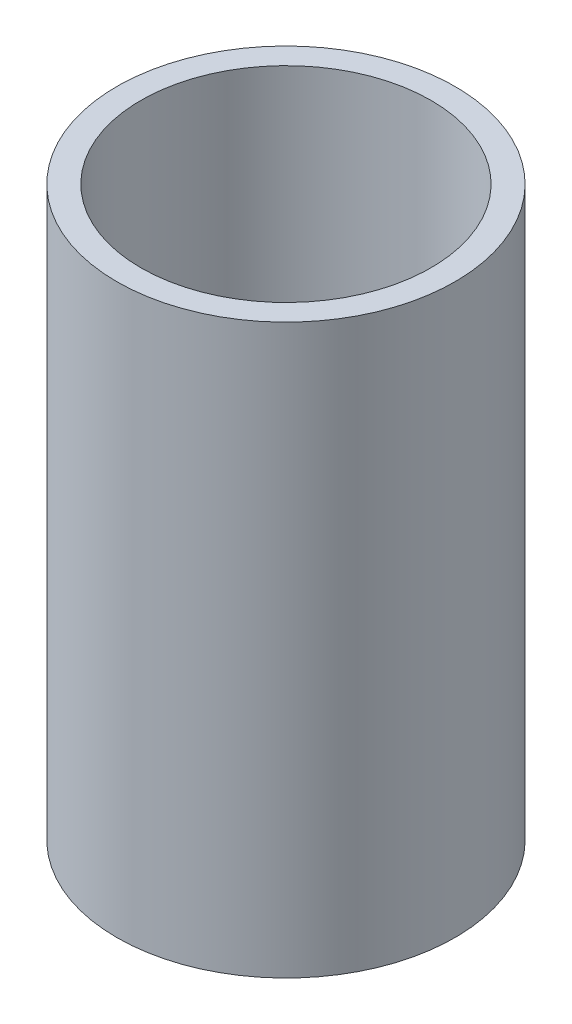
SolidWorks part; units mm, degrees
ref_plane "Front Plane" through (0, 0, 0) normal (0, 0, 1) x (1, 0, 0)
ref_plane "Top Plane" through (0, 0, 0) normal (0, 1, 0) x (1, 0, 0)
ref_plane "Right Plane" through (0, 0, 0) normal (1, 0, 0) x (0, 0, -1)
sketch "Sketch1" plane through (0, 0, 0) normal (0, 1, 0) x (1, 0, 0)
  circle A0 centre (0, 0) radius 83.185
  circle A1 centre (0, 0) radius 71.3525
  dimension "D1" = 166.37
  dimension "D2" = 142.705
extrude "Boss-Extrude1" add sketch "Sketch1" along normal blind 279.4
sketch "Sketch2" plane through (0, 0, 0) normal (0, -1, 0) x (1, 0, 0)
  line L0 (0, 0) -> (0, 83.185)
  circle A0 centre (0, 0) radius 83.185 construction
ref_plane "Plane1" through (0, 0, 0) normal (1, 0, 0) x (0, 0, 1)
sketch "Sketch4" plane through (0, 0, 0) normal (1, 0, 0) x (0, 0, 1)
  line L0 (83.185, 0) -> (83.185, -279.4)
  line L1 (83.185, -279.4) -> (71.3525, -279.4)
  line L2 (71.3525, -279.4) -> (71.3525, 0)
  line L3 (71.3525, 0) -> (83.185, 0)
  line L4 (70.4889, -279.4) -> (71.3525, -278.5364)
  line L5 (0, 0) -> (0, -358.7098)
  line L6 (70.4889, -279.4) -> (71.3525, -279.4)
  dimension "D1" = 135
  dimension "D2" = 0.8636
sketch "Sketch5" plane through (0, 279.4, 0) normal (0, 1, 0) x (1, 0, 0)
  circle A0 centre (0, 0) radius 83.185
  circle A1 centre (0, 0) radius 71.3525
  circle A2 centre (0, 0) radius 71.3525 construction
  dimension "D2" = 166.37
extrude "Boss-Extrude2" add sketch "Sketch5" against normal blind 12.7
sketch "Sketch6" plane through (0, 28.1168, 0) normal (0.5394, 0, -0.8421) x (-0.8421, 0, -0.5394)
  line L0 (71.3525, -24.9418) -> (68.1775, -28.1168)
  line L1 (71.3525, -28.1168) -> (71.3525, 251.2832) construction
  line L2 (-83.185, -28.1168) -> (83.185, -28.1168) construction
  line L3 (71.3525, -24.9418) -> (71.3525, -28.1168)
  line L4 (71.3525, -28.1168) -> (68.1775, -28.1168)
  line L5 (0, -28.1168) -> (0, 25.1787)
  line L6 (0, -28.1168) -> (0, 330.593) construction
  dimension "D1" = 45
  dimension "D2" = 3.175
revolve "Revolve1" add sketch "Sketch6" angle 360 about L5
